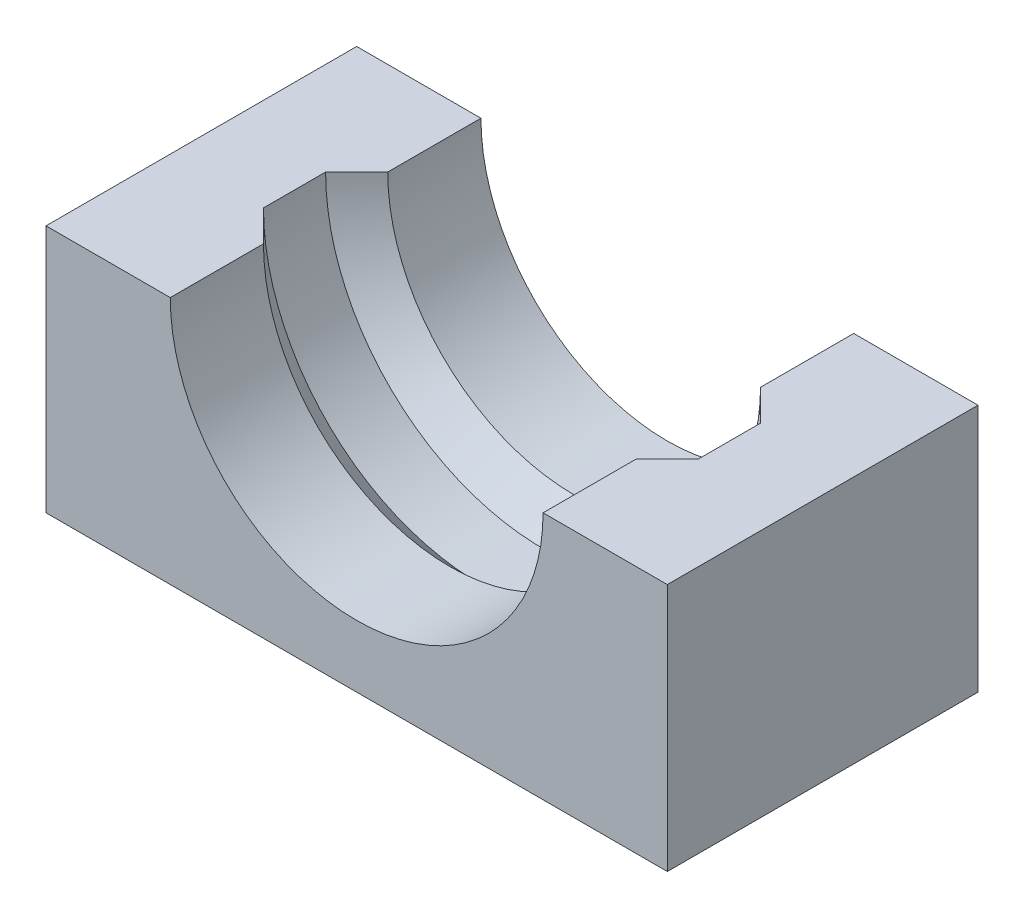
SolidWorks part; units mm, degrees
ref_plane "Front Plane" through (0, 0, 0) normal (0, 0, 1) x (1, 0, 0)
ref_plane "Top Plane" through (0, 0, 0) normal (0, 1, 0) x (1, 0, 0)
ref_plane "Right Plane" through (0, 0, 0) normal (1, 0, 0) x (0, 0, -1)
sketch "Sketch2" plane through (0, 0, 0) normal (0, 0, 1) x (1, 0, 0)
  line L0 (0, 0) -> (0, 40)
  line L1 (0, 40) -> (20, 40)
  line L2 (80, 40) -> (100, 40)
  line L3 (100, 40) -> (100, 0)
  line L4 (100, 0) -> (0, 0)
  arc A0 (20, 40) -> (80, 40) centre (50, 40) ccw
  dimension "D3" = 30
  dimension "D1" = 40
  dimension "D2" = 100
extrude "Extrude1" add sketch "Sketch2" along normal mid plane 50
sketch "Sketch3" plane through (0, 40, 0) normal (0, 1, 0) x (-1, 0, 0)
  line L0 (-50, -25) -> (-50, 25) construction
  line L1 (-80, -25) -> (-20, -25) construction
  line L2 (-20, 25) -> (-80, 25) construction
  line L3 (-20, 10) -> (-20, -10)
  line L5 (-20, 25) -> (-20, -25) construction
  line L6 (-20, -10) -> (-15, -5)
  line L7 (-15, -5) -> (-15, 5)
  line L8 (-50, 0) -> (-20, 0) construction
  line L9 (-20, 10) -> (-15, 5)
  point P14 (-15, 0)
  dimension "D1" = 5
  dimension "D2" = 10
  dimension "D3" = 20
revolve "Cut-Revolve1" cut sketch "Sketch3" angle 180 about L0
